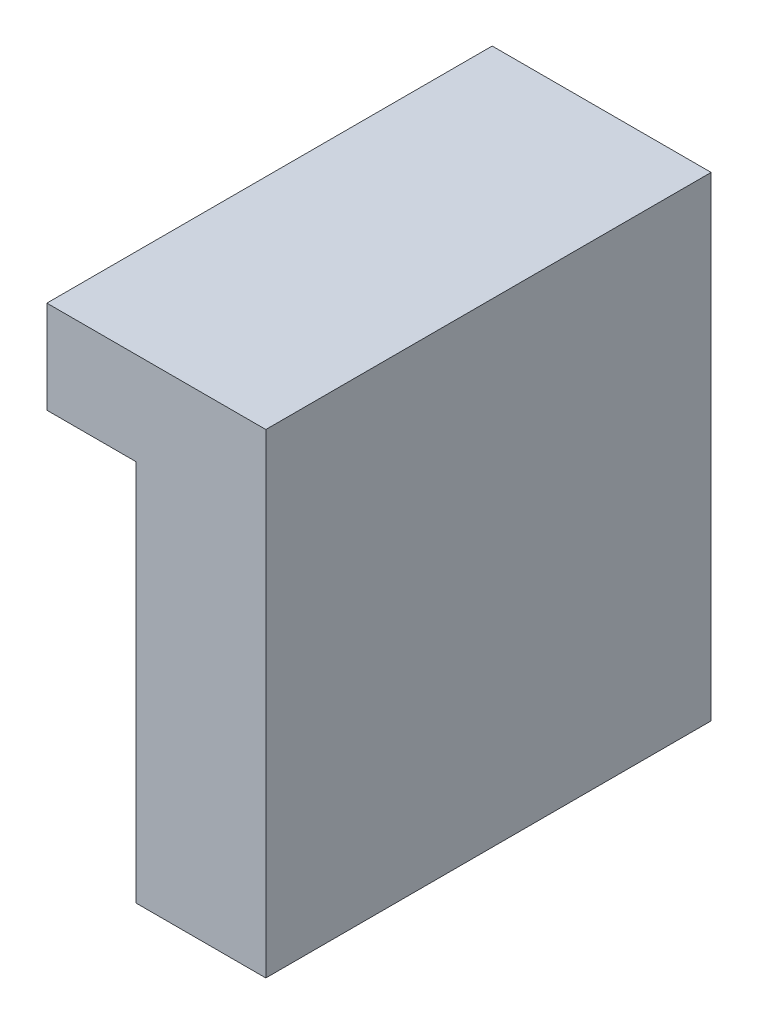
SolidWorks part; units mm, degrees
ref_plane "Ebene vorne" through (0, 0, 0) normal (0, 0, 1) x (1, 0, 0)
ref_plane "Ebene oben" through (0, 0, 0) normal (0, 1, 0) x (1, 0, 0)
ref_plane "Ebene rechts" through (0, 0, 0) normal (1, 0, 0) x (0, 0, -1)
sketch "Skizze1" plane through (0, 0, 0) normal (0, 0, 1) x (1, 0, 0)
  line L0 (0, 0) -> (0, 128)
  line L1 (0, 128) -> (-59, 128)
  line L2 (-59, 128) -> (-59, 103)
  line L3 (-59, 103) -> (-35, 103)
  line L4 (-35, 103) -> (-35, 0)
  line L5 (-35, 0) -> (0, 0)
  dimension "D1" = 59
  dimension "D2" = 25
  dimension "D3" = 103
  dimension "D4" = 24
extrude "Aufsatz-Linear austragen1" add sketch "Skizze1" against normal blind 120
